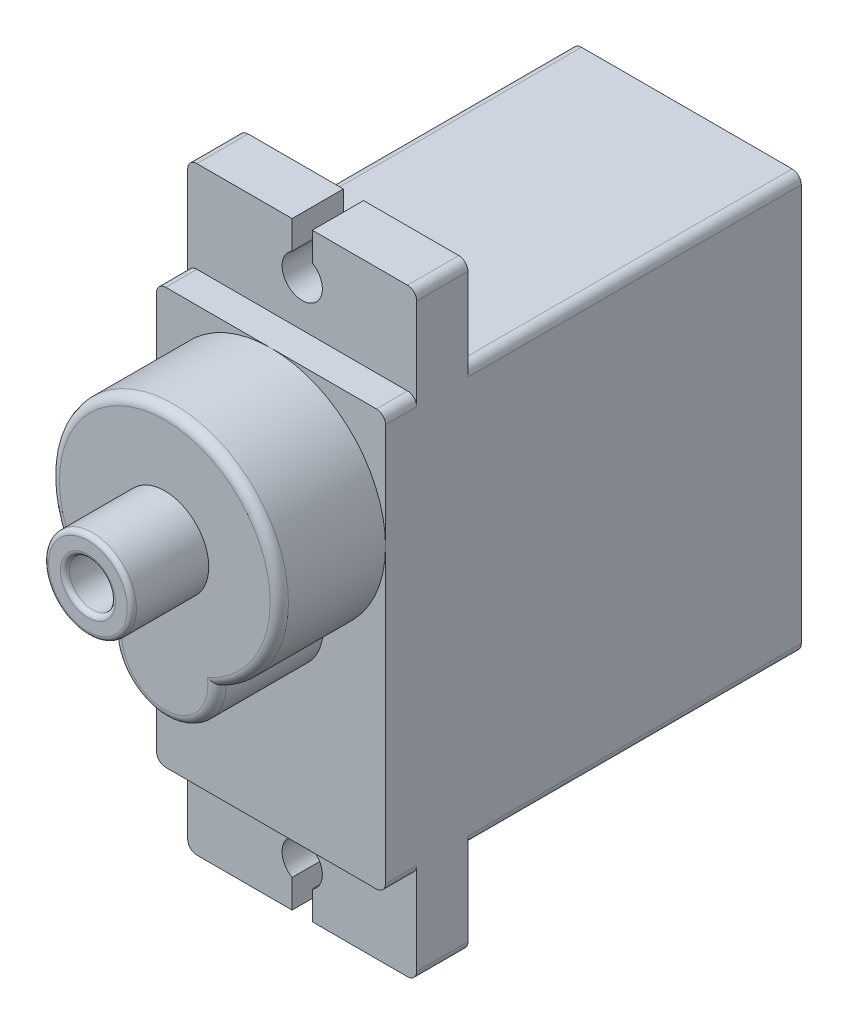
SolidWorks part; units mm, degrees
ref_plane "Спереди (Плоскость XY)" through (0, 0, 0) normal (0, 0, 1) x (1, 0, 0)
ref_plane "Сверху (Плоскость XZ)" through (0, 0, 0) normal (0, 1, 0) x (1, 0, 0)
ref_plane "Справа (Плоскость ZY)" through (0, 0, 0) normal (1, 0, 0) x (0, 0, -1)
sketch "Эскиз1" plane through (0, 0, 0) normal (0, 0, 1) x (1, 0, 0)
  line L1 (-6.25, 11.35) -> (6.25, 11.35)
  line L2 (-6.25, 11.35) -> (-6.25, -11.35)
  line L3 (-6.25, -11.35) -> (6.25, -11.35)
  line L4 (6.25, 11.35) -> (6.25, -11.35)
  line L5 (-6.25, 11.35) -> (6.25, -11.35) construction
  line L6 (-6.25, -11.35) -> (6.25, 11.35) construction
  point P0 (0, 0)
  dimension "D1" = 22.7
  dimension "D2" = 12.5
extrude "Бобышка-Вытянуть1" add sketch "Эскиз1" along normal blind 22.7
ref_plane "Плоскость1" through (0, 0, 21) normal (0, 0, 1) x (1, 0, 0)
sketch "Эскиз2" plane through (0, 0, 21) normal (0, 0, 1) x (1, 0, 0)
  line L0 (6.25, -11.35) -> (6.25, 11.35) construction
  line L1 (-6.25, 11.35) -> (6.25, 11.35)
  line L2 (-6.25, 11.35) -> (-6.25, 16.35)
  line L3 (-6.25, 16.35) -> (6.25, 16.35)
  line L4 (6.25, 11.35) -> (6.25, 16.35)
  line L5 (0, 0) -> (10.6869, 0) construction
  line L6 (6.25, -11.35) -> (6.25, -16.35)
  line L7 (-6.25, -16.35) -> (6.25, -16.35)
  line L8 (-6.25, -11.35) -> (-6.25, -16.35)
  line L9 (-6.25, -11.35) -> (6.25, -11.35)
  dimension "D1" = 5
extrude "Бобышка-Вытянуть2" add sketch "Эскиз2" against normal blind 2.8
sketch "Эскиз3" plane through (0, 0, 21) normal (0, 0, 1) x (1, 0, 0)
  line L0 (0, 0) -> (0, 50000) construction
  line L1 (0, 0) -> (10.3846, 0) construction
  line L2 (6.25, 16.35) -> (-6.25, 16.35) construction
  circle A0 centre (0, 13.85) radius 1.1
  circle A1 centre (0, -13.85) radius 1.1
  dimension "D1" = 2.2
  dimension "D2" = 2.5
extrude "Вырез-Вытянуть1" cut sketch "Эскиз3" against normal blind 2.8
fillet "Скругление1" radius 0.5 12 edges at (-6.25, -11.35, 9.1) (-6.25, -16.35, 19.6) (-6.25, -11.35, 21.85) (6.25, -11.35, 21.85) (6.25, -16.35, 19.6) (6.25, -11.35, 9.1) (6.25, 16.35, 19.6) (-6.25, 16.35, 19.6) (-6.25, 11.35, 9.1) (-6.25, 11.35, 21.85) (6.25, 11.35, 21.85) (6.25, 11.35, 9.1)
sketch "Эскиз4" plane through (0, 0, 22.7) normal (0, 0, 1) x (1, 0, 0)
  line L0 (6.25, -10.85) -> (6.25, 10.85) construction
  line L1 (5.75, 11.35) -> (-5.75, 11.35) construction
  circle A0 centre (0, 5.1) radius 6.25
extrude "Бобышка-Вытянуть3" add sketch "Эскиз4" along normal blind 5.8
sketch "Эскиз5" plane through (0, 0, 28.5) normal (0, 0, 1) x (1, 0, 0)
  line L0 (-5.75, 11.35) -> (5.75, 11.35) construction
  circle A0 centre (0, -0.5) radius 2.85
  dimension "D1" = 5.7
  dimension "D2" = 14.7
extrude "Бобышка-Вытянуть4" add sketch "Эскиз5" against normal blind 5.8
fillet "Скругление2" radius 0.5 2 edges at (0, -3.35, 28.5) (0, 11.35, 28.5)
sketch "Эскиз6" plane through (0, 0, 28.5) normal (0, 0, 1) x (1, 0, 0)
  circle A0 centre (0, 5.1) radius 2.4
  dimension "D1" = 4.8
extrude "Бобышка-Вытянуть5" add sketch "Эскиз6" along normal blind 4.2
sketch "Эскиз7" plane through (0, 0, 32.7) normal (0, 0, 1) x (1, 0, 0)
  circle A0 centre (0, 5.1) radius 1.25
  dimension "D1" = 2.5
extrude "Вырез-Вытянуть2" cut sketch "Эскиз7" against normal blind 4.2
fillet "Скругление3" radius 0.25 2 edges at (2.4, 5.1, 32.7) (1.25, 5.1, 32.7)
sketch "Эскиз8" plane through (0, 0, 21) normal (0, 0, 1) x (1, 0, 0)
  line L1 (-0.55, 13.8231) -> (0.55, 13.8231)
  line L2 (-0.55, 13.8231) -> (-0.55, 17.5205)
  line L3 (-0.55, 17.5205) -> (0.55, 17.5205)
  line L4 (0.55, 13.8231) -> (0.55, 17.5205)
  line L5 (-0.55, 13.8231) -> (0.55, 17.5205) construction
  line L6 (-0.55, 17.5205) -> (0.55, 13.8231) construction
  line L7 (-0.55, -13.733) -> (0.55, -13.733)
  line L8 (-0.55, -13.733) -> (-0.55, -17.6242)
  line L9 (-0.55, -17.6242) -> (0.55, -17.6242)
  line L10 (0.55, -13.733) -> (0.55, -17.6242)
  line L11 (-0.55, -13.733) -> (0.55, -17.6242) construction
  line L12 (-0.55, -17.6242) -> (0.55, -13.733) construction
  point P0 (0, 15.6718)
  point P7 (0, -15.6786)
  dimension "D1" = 1.1
  dimension "D2" = 1.1
extrude "Вырез-Вытянуть3" cut sketch "Эскиз8" against normal blind 3
